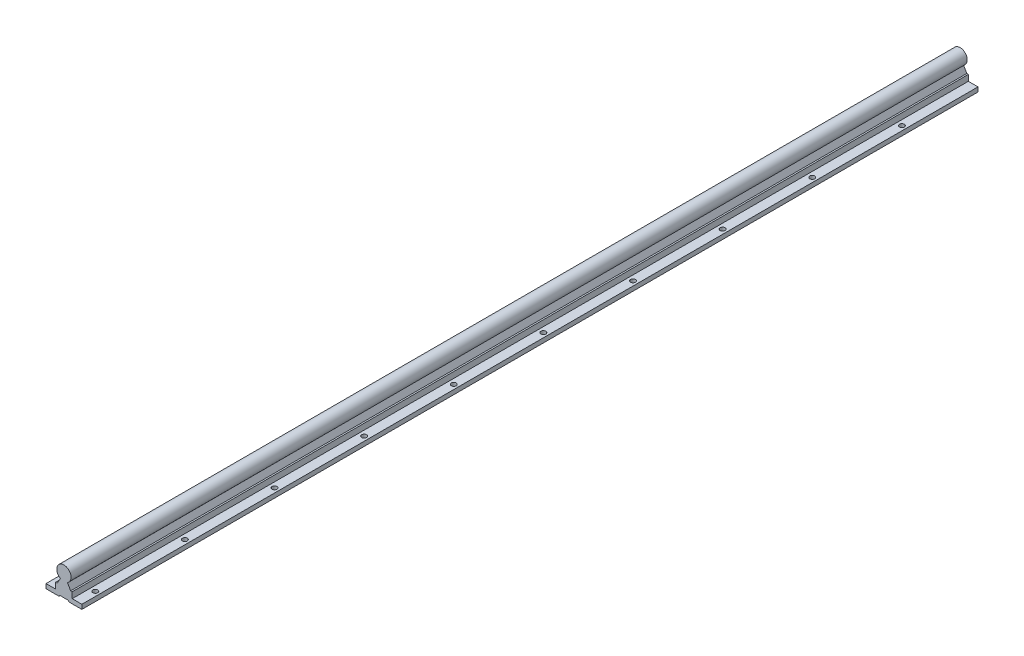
SolidWorks part; units mm, degrees
ref_plane "Front Plane" through (0, 0, 0) normal (0, 0, 1) x (1, 0, 0)
ref_plane "Top Plane" through (0, 0, 0) normal (0, 1, 0) x (1, 0, 0)
ref_plane "Right Plane" through (0, 0, 0) normal (1, 0, 0) x (0, 0, -1)
sketch "Sketch1" plane through (0, 0, 0) normal (0, 0, 1) x (1, 0, 0)
  line L0 (20, -16.5) -> (20, -11.5)
  line L1 (20, -11.5) -> (9.25, -11.5)
  line L2 (9.25, -11.5) -> (9.25, -4.8)
  line L3 (9.25, -4.8) -> (7.5218, -4.8)
  line L4 (7.5218, -4.8) -> (4, 1.3)
  line L5 (4, 1.3) -> (3.4871, 1.3)
  line L6 (-3.4871, 1.3) -> (-4, 1.3)
  line L7 (-4, 1.3) -> (-7.5218, -4.8)
  line L8 (-7.5218, -4.8) -> (-9.25, -4.8)
  line L9 (-9.25, -4.8) -> (-9.25, -11.5)
  line L10 (-9.25, -11.5) -> (-20, -11.5)
  line L11 (-20, -11.5) -> (-20, -16.5)
  line L12 (-20, -16.5) -> (-5.4717, -16.5)
  line L13 (-5.4717, -16.5) -> (-4.75, -15.25)
  line L14 (-4.75, -15.25) -> (4.75, -15.25)
  line L15 (4.75, -15.25) -> (5.4717, -16.5)
  line L16 (5.4717, -16.5) -> (20, -16.5)
  arc A0 (3.4871, 1.3) -> (-3.4871, 1.3) centre (0, 8.5) ccw
extrude "Boss-Extrude1" add sketch "Sketch1" along normal blind 1000
sketch "Sketch2" plane through (0, -11.5, 0) normal (0, 1, 0) x (1, 0, 0)
  line L0 (20, -1000) -> (9.25, -1000) construction
  line L1 (20, -1000) -> (20, 0) construction
  point P0 (15, -980)
  dimension "D1" = 20
  dimension "D2" = 5
hole_wizard "Ø5.5 (5.5) Diameter Hole1" positions "Sketch2" profile "Sketch3" hole size "Ø5.5" standard "DIN"
sketch "Sketch3" plane through (15, -11.5, 980) normal (1, 0, 0) x (0, 0, 1)
  line L0 (0, 0) -> (0, 5)
  line L1 (0, 5) -> (2.75, 5)
  line L2 (2.75, 5) -> (2.75, 0)
  line L5 (2.75, 0) -> (0, 0)
  line L11 (0, -6.35) -> (0, 107.95) construction
  dimension "Thru Hole Dia." = 5.5
  dimension "Thru Hole Depth" = 5
mirror "Mirror1" about plane through (0, 0, 0) normal (1, 0, 0) of "Ø5.5 (5.5) Diameter Hole1"
other "Fill Pattern1" parameters "D5"=0, "D6"=0, "D1"=100.0058, "D2"=60, "D3"=0, "D9"=10, "D7"=11, "D8"=2
